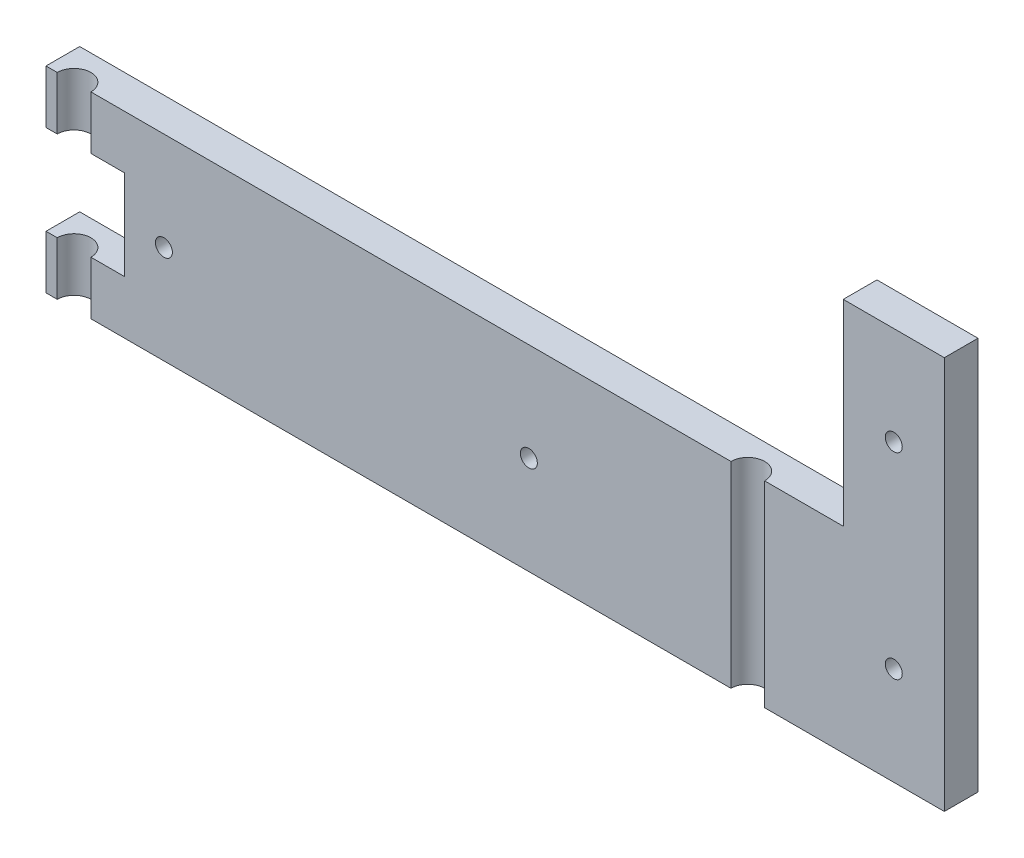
SolidWorks part; units mm, degrees
ref_plane "Plan de face" through (0, 0, 0) normal (0, 0, 1) x (1, 0, 0)
ref_plane "Plan de dessus" through (0, 0, 0) normal (0, 1, 0) x (1, 0, 0)
ref_plane "Plan de droite" through (0, 0, 0) normal (1, 0, 0) x (0, 0, -1)
sketch "Esquisse1" plane through (0, 0, 0) normal (0, 0, 1) x (1, 0, 0)
  line L0 (9, 126.1328) -> (9, -9.4638) construction
  line L1 (0, 0) -> (160, 0) construction
  line L2 (0, 0) -> (0, 120) construction
  line L3 (0, 120) -> (160, 120) construction
  line L4 (120, 50) -> (120, -6.9153) construction
  line L5 (-5, 121) -> (-5, -10) construction
  line L6 (-10.714, 17.5) -> (132.8358, 17.5) construction
  line L7 (155, 136.9664) -> (155, -26.1058) construction
  line L8 (137, 80.6011) -> (137, -4.7242) construction
  line L9 (-16.256, 70) -> (160, 70) construction
  line L10 (-9.4797, 25.5) -> (13.4274, 25.5) construction
  line L11 (153.523, 35) -> (-16.256, 35) construction
  line L12 (155, 70) -> (137, 70)
  line L13 (13.4274, 9.5) -> (-9.4797, 9.5) construction
  line L14 (137, 70) -> (137, 35)
  line L15 (137, 35) -> (-5, 35)
  line L16 (-5, 35) -> (-5, 25.5)
  line L17 (-5, 25.5) -> (9, 25.5)
  line L18 (9, 25.5) -> (9, 9.5)
  line L19 (9, 9.5) -> (-5, 9.5)
  line L20 (-5, 9.5) -> (-5, 0)
  line L21 (-5, 0) -> (155, 0)
  line L22 (155, 0) -> (155, 70)
  line L23 (146, 60) -> (146, -7.9939) construction
  circle A0 centre (146, 17.5) radius 1.51
  circle A1 centre (146, 52.5) radius 1.51
  circle A2 centre (81, 17.5) radius 1.51
  circle A3 centre (16, 17.5) radius 1.51
  dimension "D1" = 18
  dimension "D2" = 8
  dimension "D3" = 8
extrude "Extrusion1" add sketch "Esquisse1" along normal blind 6
sketch "Esquisse2" plane through (0, 0, 0) normal (0, -1, 0) x (1, 0, 0)
  circle A0 centre (0, 6) radius 3
  circle A1 centre (120, 6) radius 3
extrude "Enlèv. mat.-Extru.1" cut sketch "Esquisse2" against normal through all
